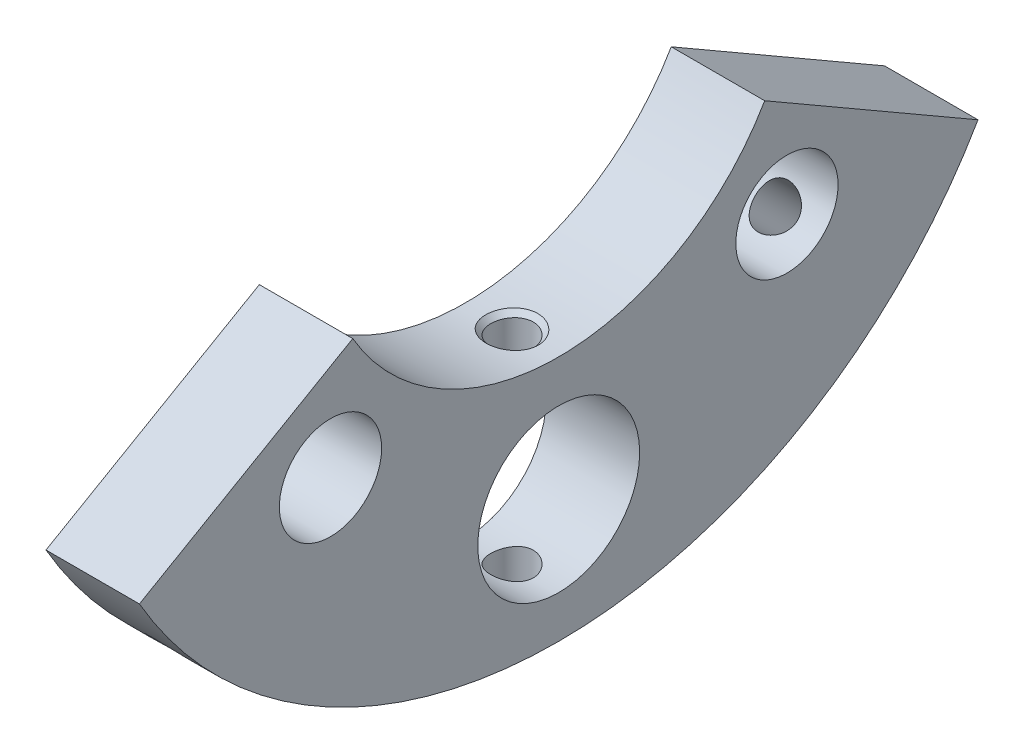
SolidWorks part; units mm, degrees
ref_plane "Front Plane" through (0, 0, 0) normal (0, 0, 1) x (1, 0, 0)
ref_plane "Top Plane" through (0, 0, 0) normal (0, 1, 0) x (1, 0, 0)
ref_plane "Right Plane" through (0, 0, 0) normal (1, 0, 0) x (0, 0, -1)
sketch "Sketch1" plane through (0, 0, 0) normal (1, 0, 0) x (0, 0, -1)
  circle A0 centre (0, 0) radius 14
  circle A1 centre (0, 0) radius 28.5
  circle A2 centre (0, 0) radius 19 construction
  dimension "D1" = 57
  dimension "D2" = 28
  dimension "D3" = 38
extrude "Boss-Extrude1" add sketch "Sketch1" along normal mid plane 5.5
hole_wizard "Ø3.0 (3) Diameter Hole1" positions "Sketch3" profile "Sketch2" hole size "Ø3.0" standard "Ansi Metric"
sketch "Sketch3" plane through (2.75, 0, 0) normal (1, 0, 0) x (0, 0, -1)
  line L0 (0, 0) -> (13.435, 13.435) construction
  line L1 (0, 0) -> (8.7822, 0) construction
  circle A1 centre (0, 0) radius 19 construction
  point P0 (13.435, 13.435)
  dimension "D2" = 45
sketch "Sketch2" plane through (2.75, 13.435, -13.435) normal (0, 1, 0) x (0, 0, -1)
  line L0 (0, 0) -> (0, 5.5)
  line L1 (0, 5.5) -> (3.01, 5.5)
  line L2 (3.01, 5.5) -> (3.01, 0)
  line L5 (3.01, 0) -> (0, 0)
  line L11 (0, -6.35) -> (0, 107.95) construction
  dimension "Thru Hole Dia." = 6.02
  dimension "Thru Hole Depth" = 5.5
hole_wizard "CBORE for M4 SHCS1" positions "Sketch5" profile "Sketch4" counterbore size "M4" standard "Ansi Metric"
sketch "Sketch5" plane through (2.75, 0, 0) normal (1, 0, 0) x (0, 0, -1)
  line L0 (18.3526, 4.9176) -> (0, 0) construction
  line L1 (0, 0) -> (13.435, 13.435) construction
  circle A1 centre (0, 0) radius 19 construction
  point P0 (18.3526, 4.9176)
  dimension "D1" = 30
sketch "Sketch4" plane through (2.75, 4.9176, -18.3526) normal (0, 1, 0) x (0, 0, -1)
  line L0 (0, 0) -> (0, 5.5)
  line L1 (0, 5.5) -> (1.525, 5.5)
  line L3 (1.525, 5.5) -> (1.525, 3.2)
  line L4 (1.525, 3.2) -> (3, 3.2)
  line L5 (3, 3.2) -> (3, 0)
  line L7 (3, 0) -> (0, 0)
  line L11 (0, -6.35) -> (0, 107.95) construction
  dimension "Thru Hole Dia." = 3.05
  dimension "Thru Hole Depth" = 5.5
  dimension "C'Bore Dia." = 6
  dimension "C'Bore Depth" = 3.2
pattern_circular "CirPattern2" count 2 every 60 about axis through (2.75, 0, 0) along (-1, 0, 0) of "CBORE for M4 SHCS1"
sketch "Sketch7" plane through (2.75, 0, 0) normal (1, 0, 0) x (0, 0, -1)
  line L0 (-10.8253, -6.25) -> (-25.9808, -15)
  line L1 (10.8253, -6.25) -> (25.9808, -15)
  line L2 (0, 0) -> (0, 6.5741) construction
  arc A2 (25.9808, -15) -> (-25.9808, -15) centre (0, 0) ccw
  arc A3 (10.8253, -6.25) -> (-10.8253, -6.25) centre (0, 0) ccw
  dimension "D1" = 25
  dimension "D2" = 60
  dimension "D3" = 120
  dimension "D4" = 60
extrude "Cut-Extrude1" cut sketch "Sketch7" against normal up to next
sketch "Sketch8" plane through (2.75, 0, 0) normal (1, 0, 0) x (0, 0, -1)
  circle A0 centre (0, -21.25) radius 4.765
  circle A1 centre (0, 0) radius 21.25 construction
  dimension "D1" = 9.53
  dimension "D2" = 42.5
extrude "Cut-Extrude2" cut sketch "Sketch8" against normal up to next
sketch "Sketch9" plane through (2.75, 0, 0) normal (1, 0, 0) x (0, 0, -1)
  circle A0 centre (13.435, -13.4351) radius 3.01
  circle A1 centre (-13.435, -13.4351) radius 3.01
  circle A3 centre (0, 0) radius 15.99 construction
  dimension "D1" = 6.02
  dimension "D2" = 6.02
  dimension "D3" = 31.98
  dimension "D4" = 26.87
  dimension "D5" = 13.435
extrude "Cut-Extrude3" cut sketch "Sketch9" against normal up to next
hole_wizard "M3x0.5 Tapped Hole7" positions "Sketch27" profile "Sketch26" tap size "M3x0.5" standard "Ansi Metric"
sketch "Sketch27" plane through (0, 0, 0) normal (0, 1, 0) x (1, 0, 0)
  point P0 (0, 0)
sketch "Sketch26" plane through (0, 0, 0) normal (1, 0, 0) x (0, 0, 1)
  line L0 (0, 0) -> (0, 28.5)
  line L1 (0, 28.5) -> (1.25, 28.5)
  line L2 (1.25, 28.5) -> (1.25, 0.5)
  line L3 (1.25, 0.5) -> (1.75, 0)
  line L5 (1.75, 0) -> (0, 0)
  line L6 (-1.25, 0.5) -> (-1.75, 0) construction
  line L11 (0, -6.35) -> (0, 107.95) construction
  dimension "Thru Tap Drill Dia." = 2.5
  dimension "Thru Tap Drill Depth" = 28.5
  dimension "Near C'Sink Dia." = 3.5
  dimension "Near C'Sink Angle" = 90
ref_plane "Plane6" through (0, -13.435, -13.435) normal (0, -0.7071, -0.7071) x (1, 0, 0)
hole_wizard "M3x0.5 Tapped Hole8" positions "Sketch30" profile "Sketch31" tap size "M3x0.5" standard "Ansi Metric"
sketch "Sketch30" plane through (0, -13.435, -13.435) normal (0, -0.7071, -0.7071) x (1, 0, 0)
  line L0 (-2.75, 28.5) -> (-2.75, -7.3763) construction
  line L2 (-2.75, 0) -> (2.75, 0) construction
  point P0 (0, 0)
  dimension "D1" = 2.75
  dimension "D2" = 0
sketch "Sketch31" plane through (0, -13.4351, -13.435) normal (1, 0, 0) x (0, -0.7071, 0.7071)
  line L0 (0, 0) -> (0, 18.6052)
  line L1 (0, 18.6052) -> (1.25, 18.6052)
  line L2 (1.25, 18.6052) -> (1.25, 0.5)
  line L3 (1.25, 0.5) -> (1.75, 0)
  line L5 (1.75, 0) -> (0, 0)
  line L6 (-1.25, 0.5) -> (-1.75, 0) construction
  line L11 (0, -6.35) -> (0, 107.95) construction
  dimension "Thru Tap Drill Dia." = 2.5
  dimension "Thru Tap Drill Depth" = 18.6052
  dimension "Near C'Sink Dia." = 3.5
  dimension "Near C'Sink Angle" = 90
mirror "Mirror3" about plane through (0, 0, 0) normal (0, 0, 1) of "M3x0.5 Tapped Hole8"
chamfer "Chamfer1" distance 0.3 angle 45 1 edges at (-0.2819, -13.9469, -1.2178)
sketch "Sketch32" plane through (2.75, 0, 0) normal (1, 0, 0) x (0, 0, -1)
  line L0 (0, -28.5) -> (0, -26.015) construction
  line L1 (0, -16.485) -> (0, -14) construction
  arc A0 (-24.6817, -14.25) -> (24.6817, -14.25) centre (0, 0) ccw construction
  circle A1 centre (0, -21.25) radius 4.765 construction
  arc A2 (-12.1244, -7) -> (12.1244, -7) centre (0, 0) ccw construction
  dimension "D1" = 2.485
  dimension "D2" = 2.485
